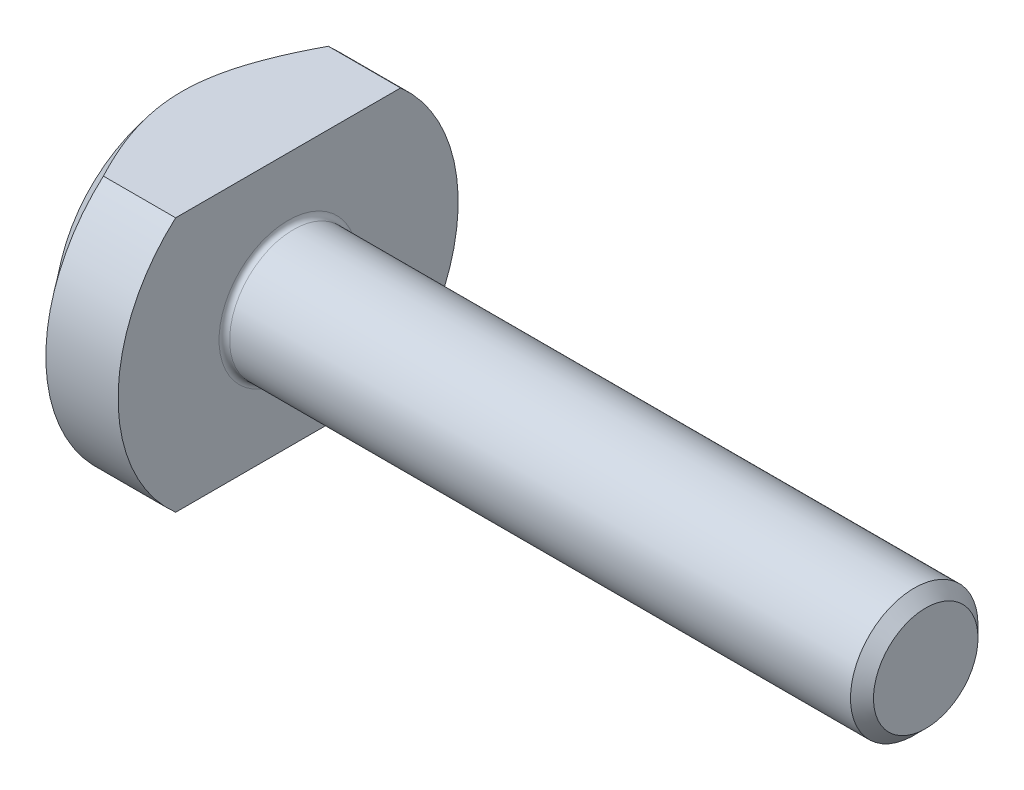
SolidWorks part; units mm, degrees
ref_plane "Front" through (0, 0, 0) normal (0, 0, 1) x (1, 0, 0)
ref_plane "Top" through (0, 0, 0) normal (0, 1, 0) x (1, 0, 0)
ref_plane "Right" through (0, 0, 0) normal (1, 0, 0) x (0, 0, -1)
sketch "Sketch1" plane through (-1.5176, 0, -6.4824) normal (0, 1, 0) x (0, 0, -1)
  line L0 (-6.4824, -1.5176) -> (-14.4824, -1.5176)
  line L1 (-14.4824, -1.5176) -> (-14.4824, 1.8824)
  line L2 (-12.1824, 3.7224) -> (-6.4824, 3.7224)
  line L3 (-6.4824, 3.7224) -> (-6.4824, -1.5176)
  line L4 (-6.4824, 5.8737) -> (-6.4824, -3.9441) construction
  line L5 (-12.1824, 3.7224) -> (-14.4824, 1.8824)
  dimension "D1" = 16
  dimension "h" = 3.4
  dimension "k" = 5.24
  dimension "D" = 11.4
revolve "BaseHead" add sketch "Sketch1" angle 360 about L4
sketch "Sketch2" plane through (0, 0, 0) normal (1, 0, 0) x (0, 0, -1)
  line L0 (5.2915, 6) -> (-5.2915, 6)
  line L3 (5.2915, -6) -> (-5.2915, -6)
  arc A1 (5.2915, 6) -> (-5.2915, 6) centre (0, 0) ccw
  arc A2 (-5.2915, -6) -> (5.2915, -6) centre (0, 0) ccw
  circle A3 centre (0, 0) radius 8 construction
  dimension "D2" = 6
  dimension "s" = 12
extrude "Cut-Extrude1" cut sketch "Sketch2" against normal through all
sketch "Sketch3" plane through (0, -0.7254, 3.537) normal (1, 0, 0) x (0, 0, -1)
  circle A0 centre (3.537, 0.7254) radius 3
  dimension "d" = 6
extrude "BaseBody" add sketch "Sketch3" along normal blind 30
ref_plane "Plane1" through (12, 0, 0) normal (1, 0, 0) x (0, 0, -1)
fillet "HeadFillet" radius 0.25 1 edges at (0, 0, -3)
chamfer "Chamfer1" distance 0.5415 angle 45 1 edges at (30, 0, -3)
sketch "Sketch4" [suppressed] plane through (0, 0, 0) normal (0, 1, 0) x (1, 0, 0)
  line L0 (28.917, 3.5415) -> (29.4585, 3.5415)
  line L1 (29.4585, 3.5415) -> (29.4585, 3)
  line L2 (29.4585, 3) -> (29.1877, 2.531)
  line L3 (29.1877, 2.531) -> (28.917, 3)
  line L4 (28.917, 3) -> (28.917, 3.5415)
  line L5 (29.4585, 3) -> (29.4585, -3) construction
  line L6 (29.4585, 3) -> (0.25, 3) construction
  dimension "D1" = 0.5415
revolve "Cut-Revolve10" [suppressed] cut sketch "Sketch4" angle 360
pattern_linear "LPattern10" [suppressed] count 27
equation "\"D2@Sketch2\" = \"s@Sketch2\" / 2"
equation "\"C1@Chamfer1\" =  ( \"d@Sketch3\" - \"D2@ThreadCosmetic1\" ) / 2 "
equation "\"Lb@ThreadCosmetic1\" = \"b@Plane1\" - \"C1@Chamfer1\""
equation "\"D1@Sketch4\" =  ( \"d@Sketch3\" - \"D2@ThreadCosmetic1\" )  / 2"
equation "\"pitch@LPattern10\" = 1.2 * \"D1@Sketch4\""
equation " \"D1@LPattern10\" = \"Lb@ThreadCosmetic1\" / \"pitch@LPattern10\""
equation "\"D@Sketch1\" = 0.95 * \"s@Sketch2\""
